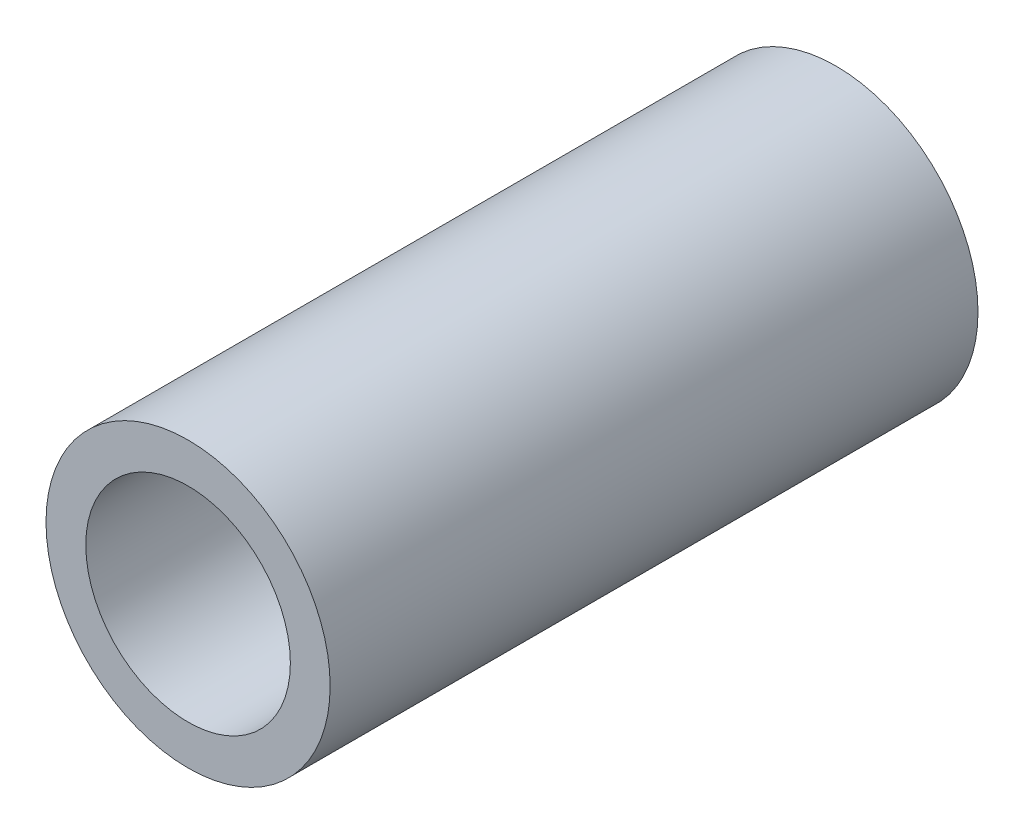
SolidWorks part; units mm, degrees
ref_plane "Plan de face" through (0, 0, 0) normal (0, 0, 1) x (1, 0, 0)
ref_plane "Plan de dessus" through (0, 0, 0) normal (0, 1, 0) x (1, 0, 0)
ref_plane "Plan de droite" through (0, 0, 0) normal (1, 0, 0) x (0, 0, -1)
sketch "Esquisse1" plane through (0, 0, 0) normal (0, 0, 1) x (1, 0, 0)
  circle A0 centre (0, 0) radius 9
  circle A1 centre (0, 0) radius 12.5
  dimension "D1" = 18
  dimension "D2" = 25
extrude "Extrusion1" add sketch "Esquisse1" along normal mid plane 57
